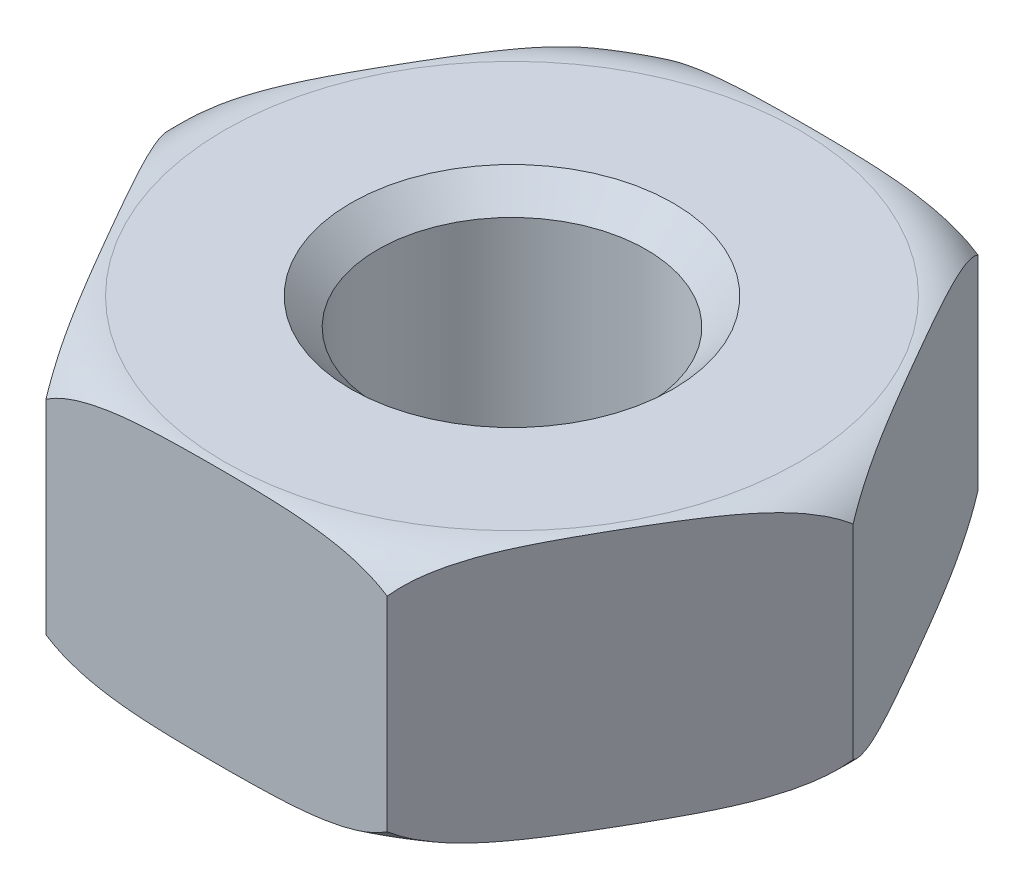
SolidWorks part; units mm, degrees
ref_plane "Plan de face" through (0, 0, 0) normal (0, 0, 1) x (1, 0, 0)
ref_plane "Plan de dessus" through (0, 0, 0) normal (0, 1, 0) x (1, 0, 0)
ref_plane "Plan de droite" through (0, 0, 0) normal (1, 0, 0) x (0, 0, -1)
sketch "Esquisse1" plane through (0, 0, 0) normal (0, 1, 0) x (1, 0, 0)
  line L1 (1.5877, -2.75) -> (3.1754, 0)
  line L2 (3.1754, 0) -> (1.5877, 2.75)
  line L3 (1.5877, 2.75) -> (-1.5877, 2.75)
  line L4 (-1.5877, 2.75) -> (-3.1754, 0)
  line L5 (-3.1754, 0) -> (-1.5877, -2.75)
  line L6 (-1.5877, -2.75) -> (1.5877, -2.75)
  circle A0 centre (0, 0) radius 2.75 construction
  dimension "D1" = 5.5
extrude "Boss.-Extru.1" add sketch "Esquisse1" along normal blind 2.4
sketch "Esquisse2" plane through (0, 0, 0) normal (0, 0, 1) x (1, 0, 0)
  line L0 (-3.1754, 0) -> (-3.1754, 0.25)
  line L1 (-3.1754, 0.25) -> (-2.6754, 0) construction
  line L2 (-3.1754, 0) -> (-1.5877, 0) construction
  line L3 (-2.6754, 0) -> (-3.1754, 0)
  line L4 (0, 0) -> (0, 2.4) construction
  line L5 (-1.5877, 0) -> (1.5877, 0) construction
  line L6 (-1.5877, 2.4) -> (1.5877, 2.4) construction
  arc A0 (-3.1754, 0.25) -> (-2.6754, 0) centre (-2.6754, 0.625) ccw
  dimension "D1" = 0.25
  dimension "D2" = 0.5
revolve "Enlèvement de matière-Révolution1" cut sketch "Esquisse2" angle 360 about L4
ref_plane "Plan1" through (0, 1.2, 0) normal (0, 1, 0) x (1, 0, 0)
mirror "Symétrie1" about plane through (0, 1.2, 0) normal (0, 1, 0) of "Enlèvement de matière-Révolution1"
sketch "Esquisse4" plane through (0, 2.4, 0) normal (0, 1, 0) x (1, 0, 0)
  circle A0 centre (0, 0) radius 2.6
  circle A3 centre (0, 0) radius 2.6754 construction
  dimension "D1" = 5.2
extrude "Boss.-Extru.2" [suppressed] add sketch "Esquisse4" along normal blind 2.35
fillet "Congé1" [suppressed] radius 0.5
hole_wizard "Trou taraudé M31" positions "Esquisse3D1" profile "Esquisse3" tap size "M3" standard "ISO"
sketch3d "Esquisse3D1"
  point P4 (0, 0, 0)
sketch "Esquisse3" plane through (0, 0, 0) normal (1, 0, 0) x (0, 0, -1)
  line L0 (0, 0) -> (0, 2.4)
  line L1 (0, 2.4) -> (1.25, 2.4)
  line L2 (1.25, 2.4) -> (1.25, 0)
  line L5 (1.25, 0) -> (0, 0)
  line L11 (0, -6.35) -> (0, 107.95) construction
  dimension "Diamètre du trou pour taraudage jusqu'au prochain" = 2.5
  dimension "Profondeur du trou pour taraudage jusqu'au prochain" = 2.4
chamfer "Chanfrein1" [suppressed] distance 0.25 angle 45
chamfer "Chanfrein2" distance 0.25 angle 45 2 edges at (0, 0, -1.25) (0, 2.4, -1.25)
